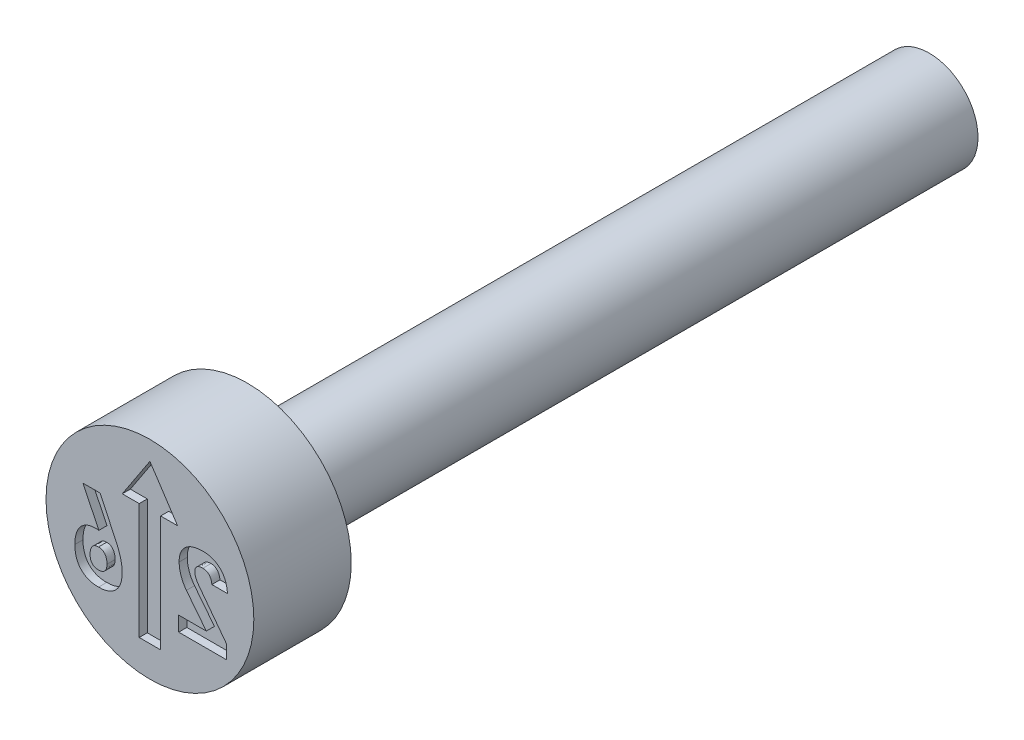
SolidWorks part; units mm, degrees
ref_plane "Front Plane" through (0, 0, 0) normal (0, 0, 1) x (1, 0, 0)
ref_plane "Top Plane" through (0, 0, 0) normal (0, 1, 0) x (1, 0, 0)
ref_plane "Right Plane" through (0, 0, 0) normal (1, 0, 0) x (0, 0, -1)
imported_body "Imported1"
sketch "Sketch1" plane through (0, 0, -0.569) normal (0, 0, 1) x (1, 0, 0)
  line L7 (0.8513, 1.3208) -> (0, 2.613)
  line L8 (0, 2.613) -> (-0.8513, 1.3208)
  line L9 (-0.8513, 1.3208) -> (-0.33, 1.3208)
  line L10 (-0.33, 1.3208) -> (-0.33, -2.25)
  line L11 (-0.33, -2.25) -> (0.33, -2.25)
  line L12 (0.33, -2.25) -> (0.33, 1.3208)
  line L13 (0.33, 1.3208) -> (0.8513, 1.3208)
  line L14 (0.8513, 1.3208) -> (0, 2.613)
  line L15 (0, 2.613) -> (-0.8513, 1.3208)
  line L16 (-0.8513, 1.3208) -> (-0.33, 1.3208)
  line L17 (-0.33, 1.3208) -> (-0.33, -2.25)
  line L18 (-0.33, -2.25) -> (0.33, -2.25)
  line L19 (0.33, -2.25) -> (0.33, 1.3208)
  line L20 (0.33, 1.3208) -> (0.8513, 1.3208)
  dimension "D1" = 0
sketch "Sketch3" plane through (0, 0, 0) normal (0, 1, 0) x (1, 0, 0)
  line L0 (1.75, 24) -> (-1.75, 24) construction
  line L1 (1.5, 24) -> (1.75, 24)
  line L2 (1.5, 24) -> (1.5, 3)
  line L3 (1.5, 3) -> (1.75, 3)
  line L4 (1.75, 24) -> (1.75, 3)
  line L5 (3.2, 3) -> (-3.2, 3) construction
  line L6 (0, 24) -> (0, 25.7321) construction
  dimension "D1" = 3
  dimension "D2" = 0.25
revolve "Cut-Revolve1" cut sketch "Sketch3" angle 360 about L6
sketch "Sketch2" plane through (0, 0, 0) normal (0, 0, 1) x (1, 0, 0)
  text T0 "2  6" font "Bahnschrift" height 2.5
  dimension "D1" = 1.5
extrude "Cut-Extrude2" cut sketch "Sketch2" against normal blind 0.25
extrude "Boss-Extrude2" add sketch "Sketch1" along normal blind 0.32
